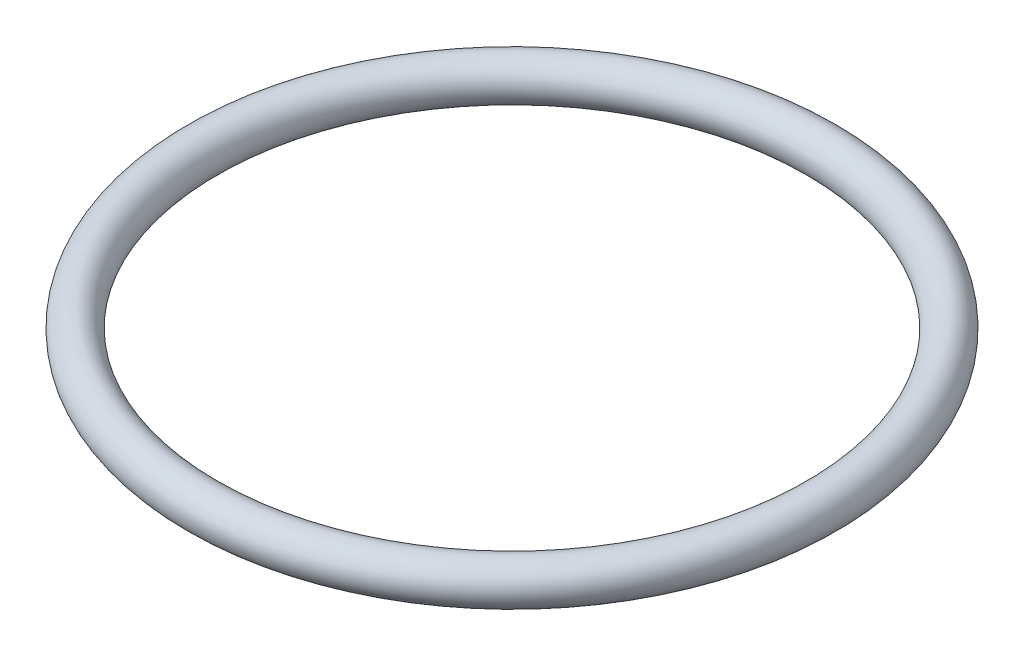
SolidWorks part; units mm, degrees
ref_plane "Front Plane" through (0, 0, 0) normal (0, 0, 1) x (1, 0, 0)
ref_plane "Top Plane" through (0, 0, 0) normal (0, 1, 0) x (1, 0, 0)
ref_plane "Right Plane" through (0, 0, 0) normal (1, 0, 0) x (0, 0, -1)
sketch "Sketch1" plane through (0, 0, 0) normal (0, 0, 1) x (1, 0, 0)
  line L0 (0, 0) -> (0, 28.398) construction
  circle A0 centre (23.8125, 0) radius 1.5875
  dimension "D1" = 3.175
  dimension "D2" = 50.8
revolve "Revolve1" add sketch "Sketch1" angle 360 about L0
sketch "Profile" plane through (0, 0, 0) normal (0, 0, 1) x (1, 0, 0)
  circle A0 centre (23.8125, 0) radius 1.8415 construction
  circle A1 centre (25.654, 0) radius 0.635
  dimension "D1" = 3.683
  dimension "D2" = 1.27
sketch "Path" plane through (0, 0, 0) normal (0, 1, 0) x (1, 0, 0)
  circle A0 centre (0, 0) radius 23.8125
